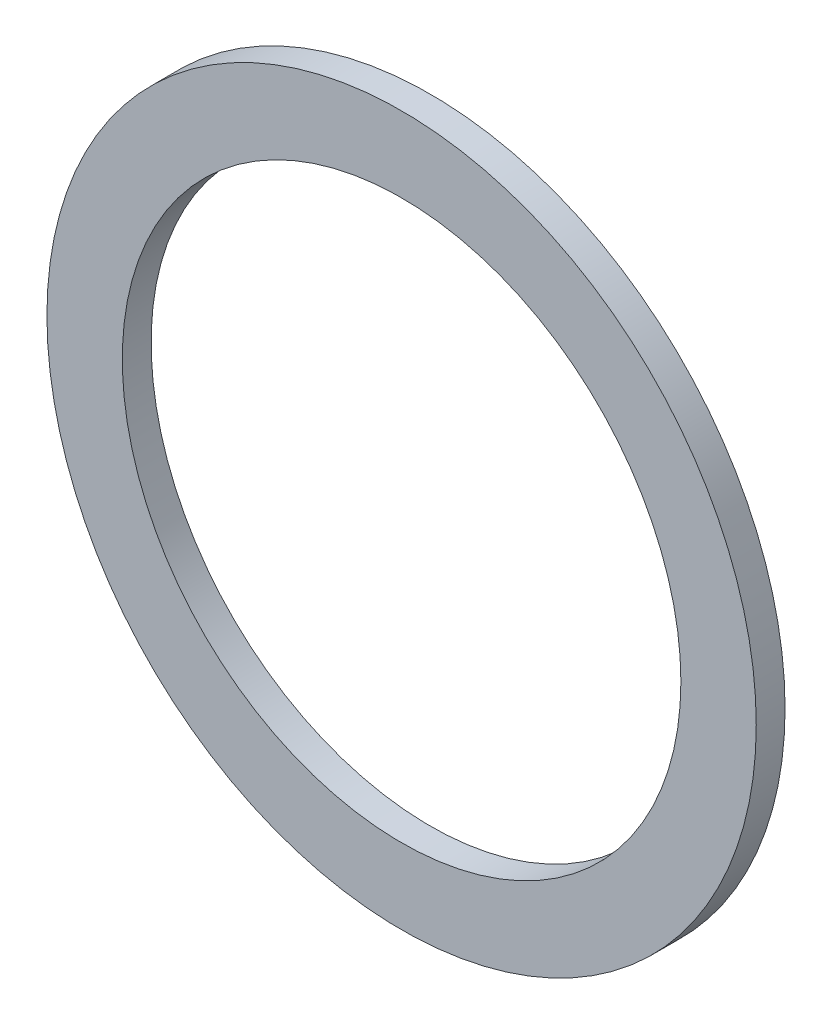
SolidWorks part; units mm, degrees
ref_plane "Plan de face" through (0, 0, 0) normal (0, 0, 1) x (1, 0, 0)
ref_plane "Plan de dessus" through (0, 0, 0) normal (0, 1, 0) x (1, 0, 0)
ref_plane "Plan de droite" through (0, 0, 0) normal (1, 0, 0) x (0, 0, -1)
sketch "Esquisse1" plane through (0, 0, 0) normal (0, 0, 1) x (1, 0, 0)
  circle A0 centre (0, 0) radius 8
  circle A1 centre (0, 0) radius 6.3
  dimension "D1" = 16
  dimension "D2" = 12.6
extrude "Boss.-Extru.1" add sketch "Esquisse1" along normal blind 0.65
